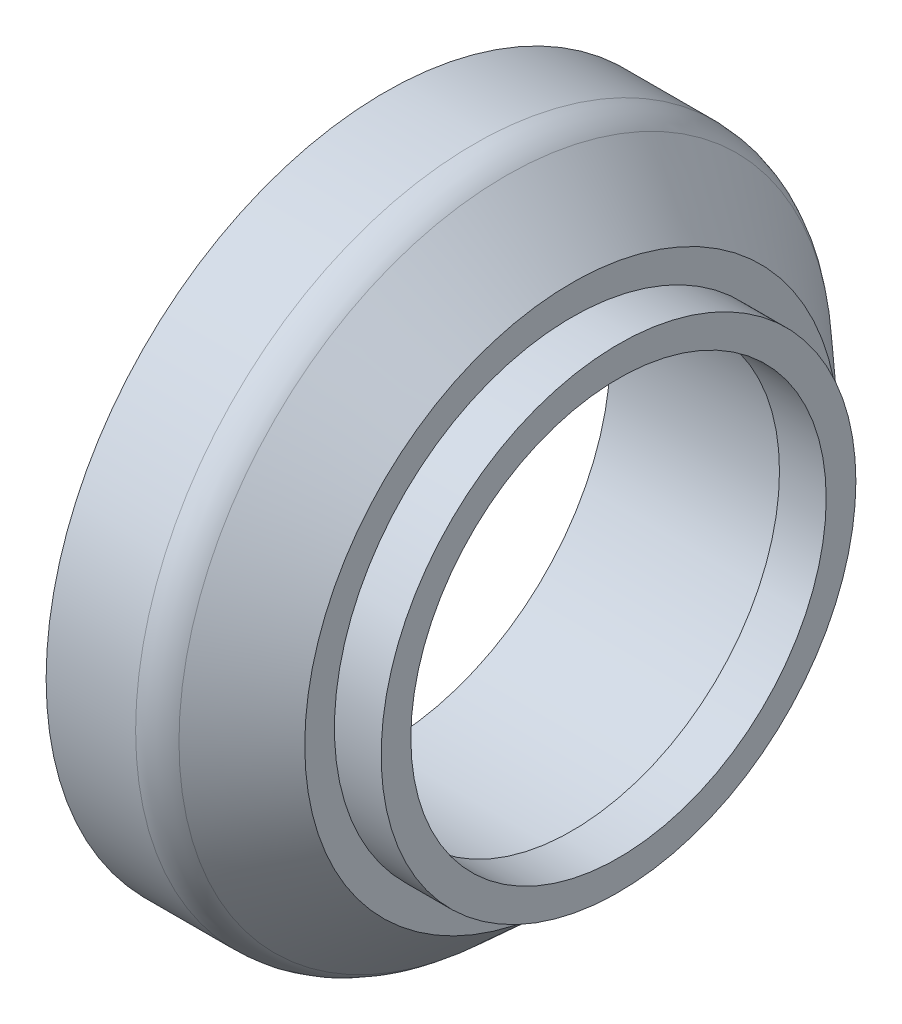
SolidWorks part; units mm, degrees
ref_plane "Front Plane" through (0, 0, 0) normal (0, 0, 1) x (1, 0, 0)
ref_plane "Top Plane" through (0, 0, 0) normal (0, 1, 0) x (1, 0, 0)
ref_plane "Right Plane" through (0, 0, 0) normal (1, 0, 0) x (0, 0, -1)
sketch "Sketch1" plane through (0, 0, 0) normal (0, 0, 1) x (1, 0, 0)
  line L0 (0, 48.25) -> (0, 0) construction
  line L1 (0, 0) -> (46.5646, 0) construction
  line L2 (0, 48.25) -> (40, 48.25)
  line L3 (40, 48.25) -> (40, 57.15)
  line L4 (40, 57.15) -> (23, 72.5)
  line L5 (23, 72.5) -> (0, 72.5)
  line L6 (0, 72.5) -> (0, 48.25)
  dimension "D1" = 40
  dimension "D2" = 48.25
  dimension "D3" = 57.15
  dimension "D4" = 72.5
  dimension "D5" = 23
revolve "Revolve1" add sketch "Sketch1" angle 360 about L1
fillet "Fillet1" radius 10 1 edges at (23, 0, 72.5)
sketch "Sketch2" plane through (40, 0, 0) normal (1, 0, 0) x (0, 0, -1)
  circle A0 centre (0, 0) radius 50.8
  circle A1 centre (0, 0) radius 44.45
  dimension "D1" = 101.6
  dimension "D2" = 88.9
extrude "Boss-Extrude1" add sketch "Sketch2" along normal blind 10
sketch "Sketch3" plane through (0, 0, 0) normal (-1, 0, 0) x (0, 0, 1)
  circle A0 centre (0, 0) radius 62.5 construction
  circle A1 centre (0, 62.5) radius 5.35
  dimension "D1" = 125
  dimension "D2" = 10.7
extrude "Cut-Extrude1" cut sketch "Sketch3" against normal blind 19.4
chamfer "Chamfer1" distance 1 angle 45 1 edges at (0, 62.5, 5.35)
pattern_circular "CirPattern1" count 12 over 360 about axis through (0, 0, 0) along (1, 0, 0) of "Chamfer1", "Cut-Extrude1"
